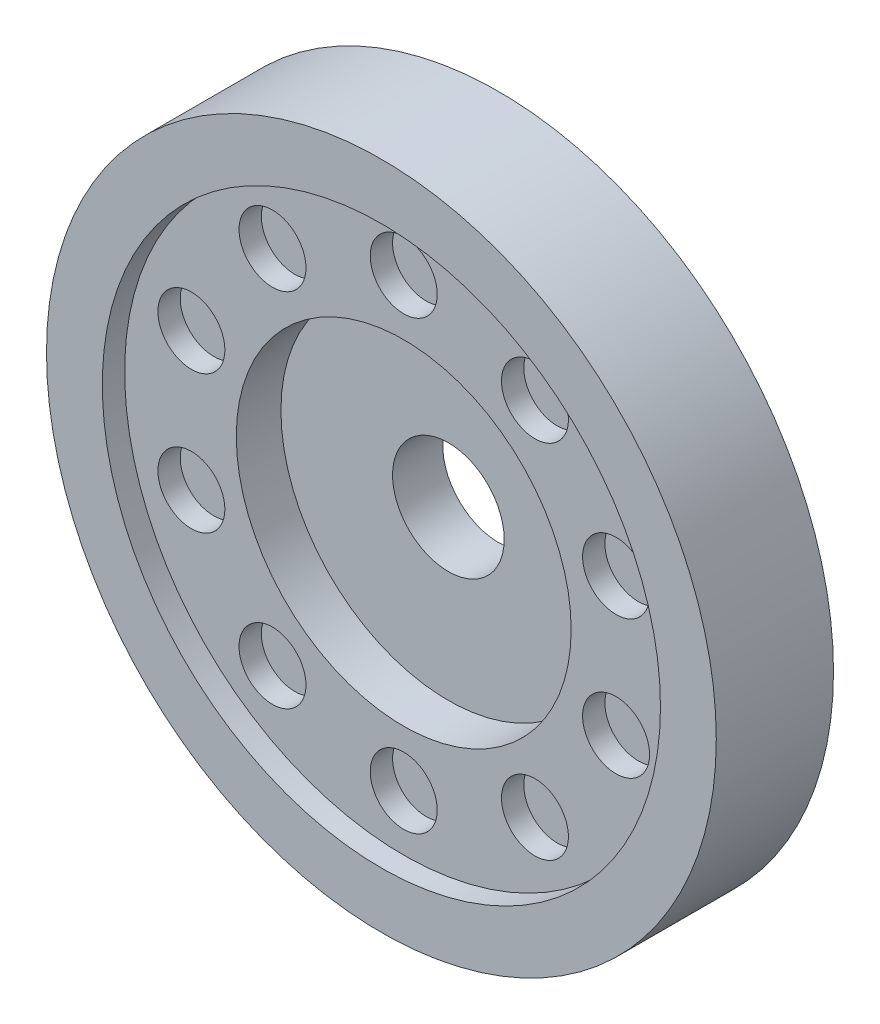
SolidWorks part; units mm, degrees
ref_plane "Front Plane" through (0, 0, 0) normal (0, 0, 1) x (1, 0, 0)
ref_plane "Top Plane" through (0, 0, 0) normal (0, 1, 0) x (1, 0, 0)
ref_plane "Right Plane" through (0, 0, 0) normal (1, 0, 0) x (0, 0, -1)
sketch "Sketch1" plane through (0, 0, 0) normal (0, 0, 1) x (1, 0, 0)
  circle A0 centre (0, 0) radius 381
  dimension "D1" = 762
extrude "Boss-Extrude1" add sketch "Sketch1" along normal mid plane 133.35
sketch "Sketch2" plane through (0, 0, 66.675) normal (0, 0, 1) x (1, 0, 0)
  circle A0 centre (0, 0) radius 317.5
  dimension "D1" = 635
extrude "Cut-Extrude1" cut sketch "Sketch2" against normal blind 25.4
sketch "Sketch3" plane through (0, 0, 41.275) normal (0, 0, 1) x (1, 0, 0)
  circle A0 centre (0, 0) radius 254 construction
  circle A1 centre (0, 254) radius 38.1
  circle A2 centre (149.2975, 205.4903) radius 38.1
  circle A3 centre (241.5684, 78.4903) radius 38.1
  circle A4 centre (241.5684, -78.4903) radius 38.1
  circle A5 centre (149.2975, -205.4903) radius 38.1
  circle A6 centre (0, -254) radius 38.1
  circle A7 centre (-149.2975, -205.4903) radius 38.1
  circle A8 centre (-241.5684, -78.4903) radius 38.1
  circle A9 centre (-241.5684, 78.4903) radius 38.1
  circle A10 centre (-149.2975, 205.4903) radius 38.1
  point P26 (0, 0)
  dimension "D1" = 508
  dimension "D2" = 76.2
  dimension "D4" = 508
  dimension "D3" = 10
extrude "Cut-Extrude2" cut sketch "Sketch3" against normal blind 25.4
sketch "Sketch4" plane through (0, 0, 41.275) normal (0, 0, 1) x (1, 0, 0)
  circle A0 centre (0, 0) radius 190.5
  dimension "D1" = 381
extrude "Cut-Extrude3" cut sketch "Sketch4" against normal blind 50.8
sketch "Sketch5" plane through (0, 0, -9.525) normal (0, 0, 1) x (1, 0, 0)
  circle A0 centre (0, 0) radius 63.5
  dimension "D1" = 127
extrude "Cut-Extrude4" cut sketch "Sketch5" against normal through all
